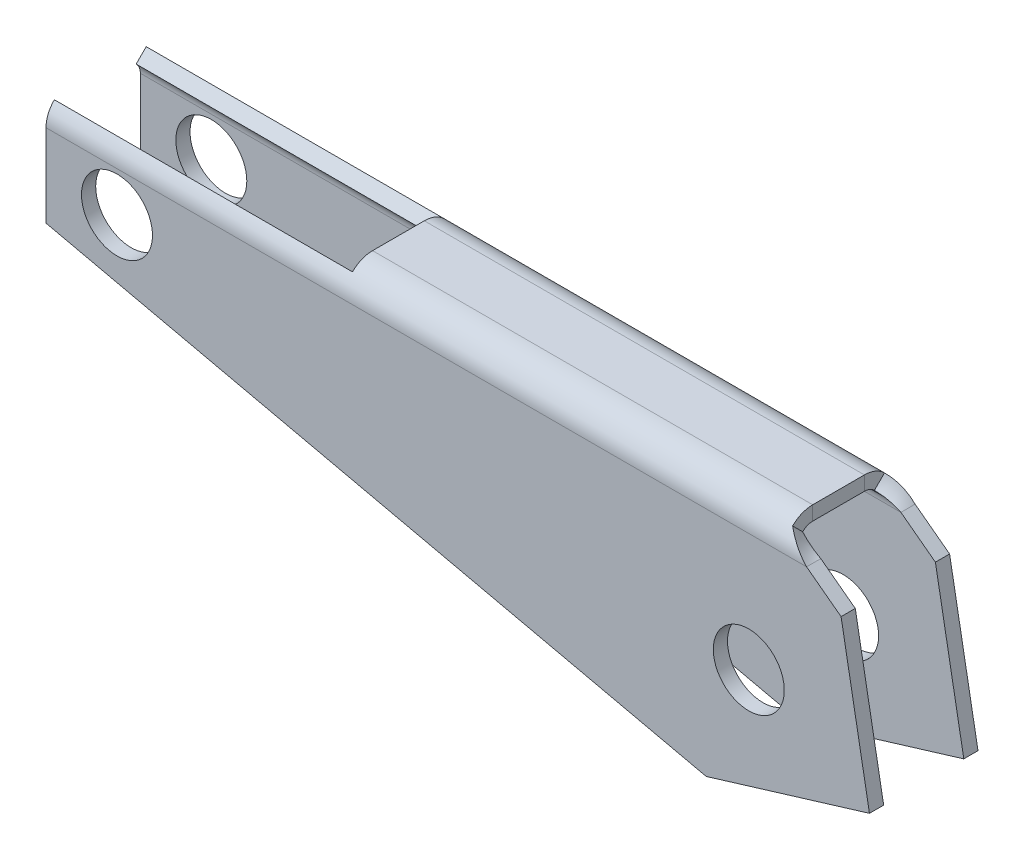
SolidWorks part; units mm, degrees
ref_plane "Plan1" through (0, 0, 0) normal (0, 0, 1) x (1, 0, 0)
ref_plane "Plan2" through (0, 0, 0) normal (0, 1, 0) x (1, 0, 0)
ref_plane "Plan3" through (0, 0, 0) normal (1, 0, 0) x (0, 0, -1)
sketch "Esquisse1" plane through (0, 0, 0) normal (0, 0, 1) x (1, 0, 0)
  line L1 (-18, 23) -> (-18, 11)
  line L3 (-80, 11) -> (-80, 23)
  line L4 (-29, -24) -> (-122, -3)
  line L5 (-18, 11) -> (-10, 5)
  line L6 (-10, 5) -> (-6, -17)
  line L7 (-6, -17) -> (-29, -24)
  line L9 (-80, 11) -> (-122, 11)
  line L10 (-122, 11) -> (-122, -3)
  line L11 (-122, 23) -> (-122, 37)
  line L12 (-80, 23) -> (-122, 23)
  line L13 (-6, 51) -> (-29, 58)
  line L14 (-10, 29) -> (-6, 51)
  line L15 (-18, 23) -> (-10, 29)
  line L16 (-29, 58) -> (-122, 37)
  circle A0 centre (-112, 3) radius 5
  circle A1 centre (-23, -8) radius 5
  circle A2 centre (-112, 31) radius 5
  circle A3 centre (-23, 42) radius 5
extrude "Base-Extrusion" add sketch "Esquisse1" against normal blind 2
sheet metal parameters "Tôlerie 3" parameters "D1"=2
flatten bends "Dépliage 4" parameters "D1"=0
sketch "Esquisse-Angle4" plane through (0, 0, 0) normal (0, 0, 1) x (1, 0, 0)
process bends "Pliage 4" parameters "D1"=0
sketch "Esquisse-Plate4" plane through (0, 0, 0) normal (0, 0, 1) x (1, 0, 0)
  line L0 (-80, 23) -> (-8, 23) construction
  line L1 (-80, 11) -> (-8, 11) construction
  point P6 (-49, -1.4)
bend "Pli défini à plat6" bend angle 90 parameters "D1"=0, "D5"=1
bend "Pli défini à plat7" bend angle 90 parameters "D1"=0, "D5"=2
